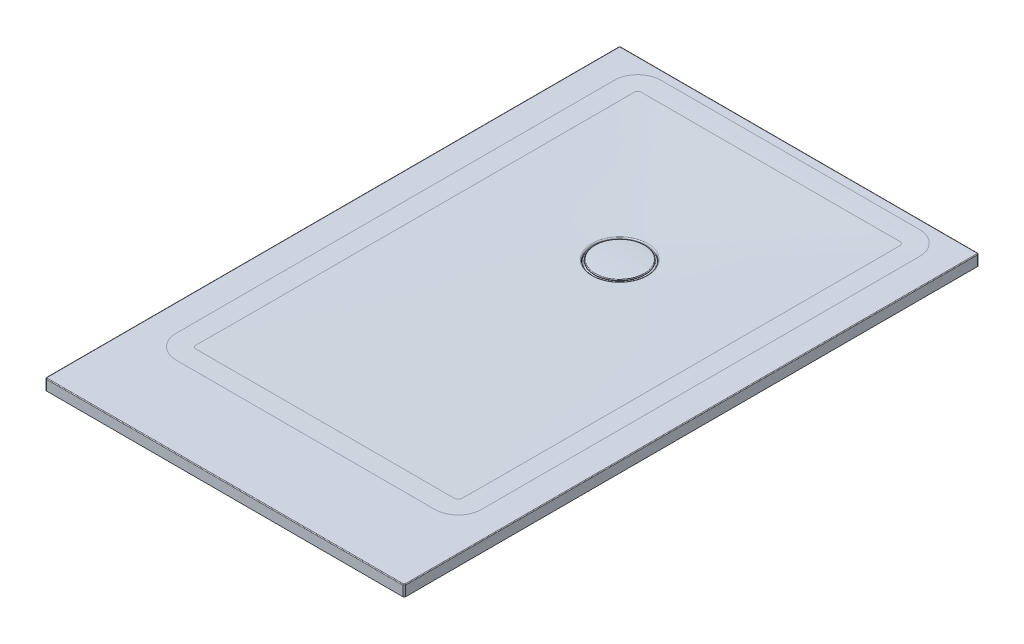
SolidWorks part; units mm, degrees
ref_plane "Płaszczyzna przednia" through (0, 0, 0) normal (0, 0, 1) x (1, 0, 0)
ref_plane "Płaszczyzna górna" through (0, 0, 0) normal (0, 1, 0) x (1, 0, 0)
ref_plane "Płaszczyzna prawa" through (0, 0, 0) normal (1, 0, 0) x (0, 0, -1)
sketch "Szkic2" plane through (0, 0, 0) normal (0, 1, 0) x (1, 0, 0)
  line L0 (0, 800) -> (0, 300) construction
  line L1 (-500, -800) -> (500, -800)
  line L2 (-500, -800) -> (-500, 800)
  line L3 (-500, 800) -> (500, 800)
  line L4 (500, -800) -> (500, 800)
  line L5 (-500, -800) -> (500, 800) construction
  line L6 (-500, 800) -> (500, -800) construction
  line L7 (-410, 760) -> (410, 760)
  line L8 (-410, 760) -> (-410, -560)
  line L9 (-410, -560) -> (410, -560)
  line L10 (410, 760) -> (410, -560)
  line L11 (-450, 800) -> (-450, -600) construction
  line L12 (-450, -600) -> (450, -600) construction
  line L13 (450, -600) -> (450, 800) construction
  circle A0 centre (0, 300) radius 75
  point P0 (0, 0)
  point P11 (0, 760)
  point P16 (0, -600)
  dimension "D9" = 150
  dimension "D1" = 1000
  dimension "D2" = 1600
  dimension "D3" = 40
  dimension "D4" = 90
  dimension "D5" = 40
  dimension "D6" = 50
  dimension "D7" = 1400
  dimension "D8" = 500
sketch "Szkic3" plane through (0, 0, 0) normal (0, 1, 0) x (1, 0, 0)
  line L0 (-500, -800) -> (-500, 800) construction
  line L1 (-500, -800) -> (500, -800) construction
  line L2 (500, -800) -> (500, 800) construction
  line L3 (-500, 800) -> (500, 800) construction
  line L4 (-410, 760) -> (-410, -560) construction
  line L5 (-410, 760) -> (410, 760) construction
  line L6 (410, 760) -> (410, -560) construction
  line L7 (-410, -560) -> (410, -560) construction
  line L8 (-500, -800) -> (-500, 800)
  line L9 (-500, -800) -> (500, -800)
  line L10 (500, -800) -> (500, 800)
  line L11 (-500, 800) -> (500, 800)
  line L12 (-410, 710) -> (-410, -510)
  line L13 (-360, 760) -> (360, 760)
  line L14 (410, 710) -> (410, -510)
  line L15 (-360, -560) -> (360, -560)
  arc A0 (410, 710) -> (360, 760) centre (360, 710) ccw
  arc A1 (-360, 760) -> (-410, 710) centre (-360, 710) ccw
  arc A2 (360, -560) -> (410, -510) centre (360, -510) ccw
  arc A3 (-360, -560) -> (-410, -510) centre (-360, -510) cw
  dimension "D1" = 50
surface "Powierzchnia-Płaszczyzna1" sketch "Szkic3"
sketch "Szkic4" plane through (0, 0, 0) normal (0, 1, 0) x (1, 0, 0)
  line L0 (-410, 760) -> (-410, -560) construction
  line L1 (-410, -560) -> (410, -560) construction
  line L2 (410, 760) -> (410, -560) construction
  line L3 (-410, 760) -> (410, 760) construction
  line L4 (-410, 760) -> (-410, -560)
  line L5 (-410, -560) -> (410, -560)
  line L6 (410, 760) -> (410, -560)
  line L7 (-410, 760) -> (410, 760)
ref_plane "korek" through (0, -15, 0) normal (0, 1, 0) x (-1, 0, 0)
sketch "Szkic5" plane through (0, -15, 0) normal (0, 1, 0) x (-1, 0, 0)
  circle A0 centre (0, -300) radius 75 construction
  circle A1 centre (0, -300) radius 75
surface "Powierzchnia-Wyciągnięcie po profilach2"
surface "Powierzchnia-Połącz1"
sketch "Szkic7" plane through (0, 0, 0) normal (0, 1, 0) x (1, 0, 0)
  line L27 (360, 720) -> (-360, 720)
  line L28 (-370, 710) -> (-370, -510)
  line L29 (-360, -520) -> (360, -520)
  line L30 (370, -510) -> (370, 710)
  line L31 (360, 720) -> (-360, 720)
  line L32 (-370, 710) -> (-370, -510)
  line L33 (-360, -520) -> (360, -520)
  line L34 (370, -510) -> (370, 710)
  line L35 (360, 775) -> (-360, 775)
  line L36 (-425, 710) -> (-425, -510)
  line L37 (-360, -575) -> (360, -575)
  line L38 (425, -510) -> (425, 710)
  line L39 (360, 775) -> (-360, 775)
  line L40 (-425, 710) -> (-425, -510)
  line L41 (-360, -575) -> (360, -575)
  line L42 (425, -510) -> (425, 710)
  arc A0 (370, -510) -> (360, -520) centre (360, -510) cw
  arc A1 (-370, -510) -> (-360, -520) centre (-360, -510) ccw
  arc A2 (370, 710) -> (360, 720) centre (360, 710) ccw
  arc A3 (-370, 710) -> (-360, 720) centre (-360, 710) cw
  spline S23 degree 3 poles (-591.1916, 434.1242) (176.3316, 602.8856) (377.1383, 675.139) (369.7447, 712.2675) (369.666, 712.5842) (369.4756, 713.2121) (369.3642, 713.5242) (368.9881, 714.432) (368.6814, 715.0062) (368.1376, 715.821) (367.9418, 716.0858) (367.5239, 716.5954) (367.304, 716.8378) (366.6128, 717.5298) (366.1098, 717.9437) (365.2908, 718.4921) (365.007, 718.6624) (364.4301, 718.9711) (364.1356, 719.1106) (363.5344, 719.3602) (363.2279, 719.4704) (362.6024, 719.661) (362.2822, 719.7416) (312.7807, 729.6484) (221.8385, 363.9367) (103.6725, -246.5829) knots -7.079876 -7.079876 -7.079876 -7.079876 0.125 0.125 0.1875 0.1875 0.25 0.25 0.375 0.375 0.4375 0.4375 0.5 0.5 0.625 0.625 0.6875 0.6875 0.75 0.75 0.8125 0.8125 0.875 0.875 10.392643 10.392643 10.392643 10.392643 only from (370, 710) to (360, 720)
  spline S24 degree 3 poles (-85.1484, -241.4857) (-254.3387, 530.5959) (-325.4915, 727.0598) (-362.2675, 719.7449) (-362.5842, 719.6659) (-363.2121, 719.4758) (-363.5241, 719.3642) (-364.432, 718.9882) (-365.0061, 718.6814) (-366.0926, 717.9565) (-366.6073, 717.5347) (-367.5295, 716.6128) (-367.9434, 716.1099) (-368.492, 715.2911) (-368.6622, 715.0072) (-368.971, 714.4304) (-369.1104, 714.1358) (-369.3601, 713.5347) (-369.4702, 713.2281) (-369.661, 712.6027) (-369.7414, 712.2825) (-379.3496, 664.3001) (-36.4123, 577.4327) (597.7669, 458.1692) knots -7.010685 -7.010685 -7.010685 -7.010685 0.125 0.125 0.1875 0.1875 0.25 0.25 0.375 0.375 0.5 0.5 0.625 0.625 0.6875 0.6875 0.75 0.75 0.8125 0.8125 0.875 0.875 10.097567 10.097567 10.097567 10.097567 only from (-360, 720) to (-370, 710)
  spline S25 degree 3 poles (591.192, -234.1241) (-176.3316, -402.8856) (-377.1383, -475.139) (-369.7447, -512.2675) (-369.666, -512.5842) (-369.4756, -513.2121) (-369.3642, -513.5242) (-368.9881, -514.432) (-368.6814, -515.0062) (-368.1376, -515.821) (-367.9418, -516.0858) (-367.5239, -516.5954) (-367.304, -516.8378) (-366.6128, -517.5298) (-366.1098, -517.9437) (-365.2908, -518.4921) (-365.007, -518.6624) (-364.4301, -518.9711) (-364.1356, -519.1106) (-363.5344, -519.3602) (-363.2279, -519.4704) (-362.6024, -519.661) (-362.2822, -519.7416) (-312.7807, -529.6484) (-221.8385, -163.9367) (-103.6724, 446.5832) knots -7.079876 -7.079876 -7.079876 -7.079876 0.125 0.125 0.1875 0.1875 0.25 0.25 0.375 0.375 0.4375 0.4375 0.5 0.5 0.625 0.625 0.6875 0.6875 0.75 0.75 0.8125 0.8125 0.875 0.875 10.392643 10.392643 10.392643 10.392643 only from (-370, -510) to (-360, -520)
  spline S26 degree 3 poles (85.1484, 441.4858) (254.3387, -330.5959) (325.4915, -527.0598) (362.2675, -519.7449) (362.5842, -519.6659) (363.2121, -519.4758) (363.5241, -519.3642) (364.432, -518.9882) (365.0061, -518.6814) (366.0926, -517.9565) (366.6073, -517.5347) (367.5295, -516.6128) (367.9434, -516.1099) (368.492, -515.2911) (368.6622, -515.0072) (368.971, -514.4304) (369.1104, -514.1358) (369.3601, -513.5347) (369.4702, -513.2281) (369.661, -512.6027) (369.7414, -512.2825) (379.3496, -464.3001) (36.4123, -377.4327) (-597.7669, -258.1692) knots -7.010685 -7.010685 -7.010685 -7.010685 0.125 0.125 0.1875 0.1875 0.25 0.25 0.375 0.375 0.5 0.5 0.625 0.625 0.6875 0.6875 0.75 0.75 0.8125 0.8125 0.875 0.875 10.097567 10.097567 10.097567 10.097567 only from (360, -520) to (370, -510)
  spline S31 degree 3 poles (-2420.9763, -200.3338) (-4.498, 355.2469) (438.6436, 574.7408) (424.4776, 718.4946) (424.1669, 720.5875) (423.342, 724.7388) (422.8284, 726.7972) (421.9014, 729.8581) (421.5658, 730.8757) (420.8441, 732.8943) (420.4597, 733.8906) (418.4227, 738.8081) (416.4286, 742.54) (413.4836, 746.9543) (412.8719, 747.8246) (411.6021, 749.5394) (410.9422, 750.3861) (408.9053, 752.8702) (407.4762, 754.4465) (402.9828, 758.9434) (399.7136, 761.634) (395.2774, 764.6045) (394.3699, 765.1802) (392.5354, 766.2814) (391.608, 766.8073) (388.7958, 768.3123) (386.8813, 769.2189) (382.9739, 770.8414) (380.9811, 771.5574) (377.9322, 772.4865) (376.906, 772.7721) (374.8333, 773.2938) (373.7849, 773.5305) (176.9086, 812.8761) (-120.0512, -58.2111) (-543.6444, -2069.031) knots -4.132177 -4.132177 -4.132177 -4.132177 0.0625 0.0625 0.125 0.125 0.1875 0.1875 0.21875 0.21875 0.25 0.25 0.375 0.375 0.40625 0.40625 0.4375 0.4375 0.5 0.5 0.625 0.625 0.65625 0.65625 0.6875 0.6875 0.75 0.75 0.8125 0.8125 0.84375 0.84375 0.875 0.875 6.705224 6.705224 6.705224 6.705224 only from (425, 710) to (360, 775)
  spline S32 degree 3 poles (616.59, -2046.7679) (63.0398, 207.6039) (-208.5691, 806.3544) (-374.7389, 773.3423) (-376.7972, 772.8283) (-379.8582, 771.9015) (-380.8758, 771.5658) (-382.8943, 770.8441) (-383.8906, 770.4597) (-388.8081, 768.4229) (-392.5399, 766.4285) (-396.9543, 763.4837) (-397.8245, 762.8719) (-399.5394, 761.6021) (-400.3861, 760.9422) (-402.8702, 758.9053) (-404.4465, 757.4764) (-408.9431, 752.9828) (-411.6338, 749.7137) (-414.6044, 745.2776) (-415.1801, 744.3701) (-416.2812, 742.5356) (-416.8071, 741.6082) (-418.3122, 738.7961) (-419.2187, 736.8815) (-420.8413, 732.9742) (-421.5572, 730.9813) (-422.4865, 727.9325) (-422.772, 726.9063) (-423.2938, 724.8336) (-423.5303, 723.7851) (-424.1597, 720.6362) (-424.4739, 718.5252) (-440.0264, 561.1616) (97.0086, 344.5312) (2456.4053, -74.6302) knots -4.816028 -4.816028 -4.816028 -4.816028 0.125 0.125 0.1875 0.1875 0.21875 0.21875 0.25 0.25 0.375 0.375 0.40625 0.40625 0.4375 0.4375 0.5 0.5 0.625 0.625 0.65625 0.65625 0.6875 0.6875 0.75 0.75 0.8125 0.8125 0.84375 0.84375 0.875 0.875 0.9375 0.9375 5.508561 5.508561 5.508561 5.508561 only from (-360, 775) to (-425, 710)
  spline S33 degree 3 poles (2420.9765, 400.3338) (4.498, -155.2469) (-438.6436, -374.7408) (-424.4776, -518.4946) (-424.1669, -520.5875) (-423.342, -524.7388) (-422.8284, -526.7972) (-421.9014, -529.8581) (-421.5658, -530.8757) (-420.8441, -532.8943) (-420.4597, -533.8906) (-418.4227, -538.8081) (-416.4286, -542.54) (-413.4836, -546.9543) (-412.8719, -547.8246) (-411.6021, -549.5394) (-410.9422, -550.3861) (-408.9053, -552.8702) (-407.4762, -554.4465) (-402.9828, -558.9434) (-399.7136, -561.634) (-395.2774, -564.6045) (-394.3699, -565.1802) (-392.5354, -566.2814) (-391.608, -566.8073) (-388.7958, -568.3123) (-386.8813, -569.2189) (-382.9739, -570.8414) (-380.9811, -571.5574) (-377.9322, -572.4865) (-376.906, -572.7721) (-374.8333, -573.2938) (-373.7849, -573.5305) (-176.9086, -612.8761) (120.0512, 258.2111) (543.6444, 2269.0311) knots -4.132177 -4.132177 -4.132177 -4.132177 0.0625 0.0625 0.125 0.125 0.1875 0.1875 0.21875 0.21875 0.25 0.25 0.375 0.375 0.40625 0.40625 0.4375 0.4375 0.5 0.5 0.625 0.625 0.65625 0.65625 0.6875 0.6875 0.75 0.75 0.8125 0.8125 0.84375 0.84375 0.875 0.875 6.705224 6.705224 6.705224 6.705224 only from (-425, -510) to (-360, -575)
  spline S34 degree 3 poles (-616.59, 2246.7679) (-63.0398, -7.6039) (208.5691, -606.3544) (374.7389, -573.3423) (376.7972, -572.8283) (379.8582, -571.9015) (380.8758, -571.5658) (382.8943, -570.8441) (383.8906, -570.4597) (388.8081, -568.4229) (392.5399, -566.4285) (396.9543, -563.4837) (397.8245, -562.8719) (399.5394, -561.6021) (400.3861, -560.9422) (402.8702, -558.9053) (404.4465, -557.4764) (408.9431, -552.9828) (411.6338, -549.7137) (414.6044, -545.2776) (415.1801, -544.3701) (416.2812, -542.5356) (416.8071, -541.6082) (418.3122, -538.7961) (419.2187, -536.8815) (420.8413, -532.9742) (421.5572, -530.9813) (422.4865, -527.9325) (422.772, -526.9063) (423.2938, -524.8336) (423.5303, -523.7851) (424.1597, -520.6362) (424.4739, -518.5252) (440.0264, -361.1616) (-97.0086, -144.5312) (-2456.4053, 274.6302) knots -4.816028 -4.816028 -4.816028 -4.816028 0.125 0.125 0.1875 0.1875 0.21875 0.21875 0.25 0.25 0.375 0.375 0.40625 0.40625 0.4375 0.4375 0.5 0.5 0.625 0.625 0.65625 0.65625 0.6875 0.6875 0.75 0.75 0.8125 0.8125 0.84375 0.84375 0.875 0.875 0.9375 0.9375 5.508561 5.508561 5.508561 5.508561 only from (360, -575) to (425, -510)
  spline S35 degree 3 poles (425, 710) (425, 712.1459) (424.8935, 714.2736) (424.4776, 718.4946) (424.1669, 720.5875) (423.342, 724.7388) (422.8284, 726.7972) (421.9014, 729.8581) (421.5658, 730.8757) (420.8441, 732.8943) (420.4597, 733.8906) (418.4227, 738.8081) (416.4286, 742.54) (413.4836, 746.9543) (412.8719, 747.8246) (411.6021, 749.5394) (410.9422, 750.3861) (408.9053, 752.8702) (407.4762, 754.4465) (402.9828, 758.9434) (399.7136, 761.634) (395.2774, 764.6045) (394.3699, 765.1802) (392.5354, 766.2814) (391.608, 766.8073) (388.7958, 768.3123) (386.8813, 769.2189) (382.9739, 770.8414) (380.9811, 771.5574) (377.9322, 772.4865) (376.906, 772.7721) (374.8333, 773.2938) (373.7849, 773.5305) (368.5368, 774.5793) (364.2918, 775) (360, 775) knots 0 0 0 0 0.0625 0.0625 0.125 0.125 0.1875 0.1875 0.21875 0.21875 0.25 0.25 0.375 0.375 0.40625 0.40625 0.4375 0.4375 0.5 0.5 0.625 0.625 0.65625 0.65625 0.6875 0.6875 0.75 0.75 0.8125 0.8125 0.84375 0.84375 0.875 0.875 1 1 1 1
  spline S36 degree 3 poles (-360, 775) (-364.2918, 775) (-368.5119, 774.5793) (-374.7389, 773.3423) (-376.7972, 772.8283) (-379.8582, 771.9015) (-380.8758, 771.5658) (-382.8943, 770.8441) (-383.8906, 770.4597) (-388.8081, 768.4229) (-392.5399, 766.4285) (-396.9543, 763.4837) (-397.8245, 762.8719) (-399.5394, 761.6021) (-400.3861, 760.9422) (-402.8702, 758.9053) (-404.4465, 757.4764) (-408.9431, 752.9828) (-411.6338, 749.7137) (-414.6044, 745.2776) (-415.1801, 744.3701) (-416.2812, 742.5356) (-416.8071, 741.6082) (-418.3122, 738.7961) (-419.2187, 736.8815) (-420.8413, 732.9742) (-421.5572, 730.9813) (-422.4865, 727.9325) (-422.772, 726.9063) (-423.2938, 724.8336) (-423.5303, 723.7851) (-424.1597, 720.6362) (-424.4739, 718.5252) (-424.8935, 714.28) (-425, 712.1459) (-425, 710) knots 0 0 0 0 0.125 0.125 0.1875 0.1875 0.21875 0.21875 0.25 0.25 0.375 0.375 0.40625 0.40625 0.4375 0.4375 0.5 0.5 0.625 0.625 0.65625 0.65625 0.6875 0.6875 0.75 0.75 0.8125 0.8125 0.84375 0.84375 0.875 0.875 0.9375 0.9375 1 1 1 1
  spline S37 degree 3 poles (-425, -510) (-425, -512.1459) (-424.8935, -514.2736) (-424.4776, -518.4946) (-424.1669, -520.5875) (-423.342, -524.7388) (-422.8284, -526.7972) (-421.9014, -529.8581) (-421.5658, -530.8757) (-420.8441, -532.8943) (-420.4597, -533.8906) (-418.4227, -538.8081) (-416.4286, -542.54) (-413.4836, -546.9543) (-412.8719, -547.8246) (-411.6021, -549.5394) (-410.9422, -550.3861) (-408.9053, -552.8702) (-407.4762, -554.4465) (-402.9828, -558.9434) (-399.7136, -561.634) (-395.2774, -564.6045) (-394.3699, -565.1802) (-392.5354, -566.2814) (-391.608, -566.8073) (-388.7958, -568.3123) (-386.8813, -569.2189) (-382.9739, -570.8414) (-380.9811, -571.5574) (-377.9322, -572.4865) (-376.906, -572.7721) (-374.8333, -573.2938) (-373.7849, -573.5305) (-368.5368, -574.5793) (-364.2918, -575) (-360, -575) knots 0 0 0 0 0.0625 0.0625 0.125 0.125 0.1875 0.1875 0.21875 0.21875 0.25 0.25 0.375 0.375 0.40625 0.40625 0.4375 0.4375 0.5 0.5 0.625 0.625 0.65625 0.65625 0.6875 0.6875 0.75 0.75 0.8125 0.8125 0.84375 0.84375 0.875 0.875 1 1 1 1
  spline S38 degree 3 poles (360, -575) (364.2918, -575) (368.5119, -574.5793) (374.7389, -573.3423) (376.7972, -572.8283) (379.8582, -571.9015) (380.8758, -571.5658) (382.8943, -570.8441) (383.8906, -570.4597) (388.8081, -568.4229) (392.5399, -566.4285) (396.9543, -563.4837) (397.8245, -562.8719) (399.5394, -561.6021) (400.3861, -560.9422) (402.8702, -558.9053) (404.4465, -557.4764) (408.9431, -552.9828) (411.6338, -549.7137) (414.6044, -545.2776) (415.1801, -544.3701) (416.2812, -542.5356) (416.8071, -541.6082) (418.3122, -538.7961) (419.2187, -536.8815) (420.8413, -532.9742) (421.5572, -530.9813) (422.4865, -527.9325) (422.772, -526.9063) (423.2938, -524.8336) (423.5303, -523.7851) (424.1597, -520.6362) (424.4739, -518.5252) (424.8935, -514.28) (425, -512.1459) (425, -510) knots 0 0 0 0 0.125 0.125 0.1875 0.1875 0.21875 0.21875 0.25 0.25 0.375 0.375 0.40625 0.40625 0.4375 0.4375 0.5 0.5 0.625 0.625 0.65625 0.65625 0.6875 0.6875 0.75 0.75 0.8125 0.8125 0.84375 0.84375 0.875 0.875 0.9375 0.9375 1 1 1 1
  dimension "D3" = 10
  dimension "D1" = 40
  dimension "D2" = 15
other "Usuń ścianę1"
other "Granica-Powierzchnia1"
surface "Powierzchnia-Połącz2"
sketch "Szkic9" plane through (0, 0, 0) normal (0, 1, 0) x (1, 0, 0)
  line L0 (-500, -800) -> (500, -800) construction
  line L1 (-500, -800) -> (-500, 800) construction
  line L2 (500, -800) -> (500, 800) construction
  line L3 (-500, 800) -> (500, 800) construction
  line L4 (-500, -800) -> (500, -800)
  line L5 (-500, -800) -> (-500, 800)
  line L6 (500, -800) -> (500, 800)
  line L7 (-500, 800) -> (500, 800)
surface "Powierzchnia-Wyciągnięcie1" sketch "Szkic9" parameters "D1"=30
sketch "Szkic8" plane through (0, 0, 0) normal (1, 0, 0) x (0, 0, -1)
  line L0 (300, 0) -> (300, -30) construction
  line L1 (224.9999, -15) -> (225.2968, -23.5)
  line L4 (225.2968, -23.5) -> (248, -24.0945)
  line L5 (225.2968, -23.5) -> (300, -23.5) construction
  line L6 (248, -24.0945) -> (248, -30) construction
  line L7 (300, -30) -> (225.2968, -30) construction
  line L8 (225.2968, -30) -> (225.2968, -23.5) construction
  line L9 (255, -28) -> (255, -30)
  line L10 (248, -24.0945) -> (255, -28)
  dimension "D1" = 30
  dimension "D2" = 8.5
  dimension "D3" = 2
  dimension "D4" = 1.5
  dimension "D5" = 52
  dimension "D6" = 45
  dimension "D7" = 2
surface "Powierzchnia-Obrót1" sketch "Szkic8" parameters "D1"=360
surface "Powierzchnia-Płaszczyzna2"
surface "Powierzchnia-Połącz3"
fillet "Zaokrąglenie4" radius 4 4 edges at (-500, -15, -800) (500, -15, -800) (-500, -15, 800) (500, -15, 800)
fillet "Zaokrąglenie5" radius 3 3 edges at (0, -24.0945, -352) (0, -23.5, -374.7032)
fillet "Zaokrąglenie6" radius 2 9 edges at (498.8284, 0, 798.8284) (0, 0, 800) (-498.8284, 0, 798.8284) (-500, 0, 0) (-498.8284, 0, -798.8284) (0, 0, -800) (498.8284, 0, -798.8284) (500, 0, 0) (0, -28, -345)
sketch "Szkic11" plane through (0, 0, 0) normal (1, 0, 0) x (0, 0, -1)
  line L0 (300, 0) -> (300, -30) construction
  line L1 (-796, -30) -> (796, -30) construction
  line L2 (300, -17) -> (300, -11.5)
  line L14 (370, -11.5) -> (370, -14.5) construction
  line L16 (370, -17) -> (300, -17)
  line L18 (370, -17) -> (370, -16.3377)
  line L19 (300, -11.5) -> (370, -11.5) construction
  arc A0 (370, -16.3377) -> (368.1666, -14.3446) centre (368, -16.3377) ccw
  arc A6 (368.1666, -14.3446) -> (300, -11.5) centre (300, -829.6667) ccw
  dimension "D2" = 2
  dimension "D8" = 2.5
  dimension "D9" = 17
  dimension "D10" = 5.5
  dimension "D11" = 70
revolve "Obrót1" add sketch "Szkic11" angle 360 about L0
